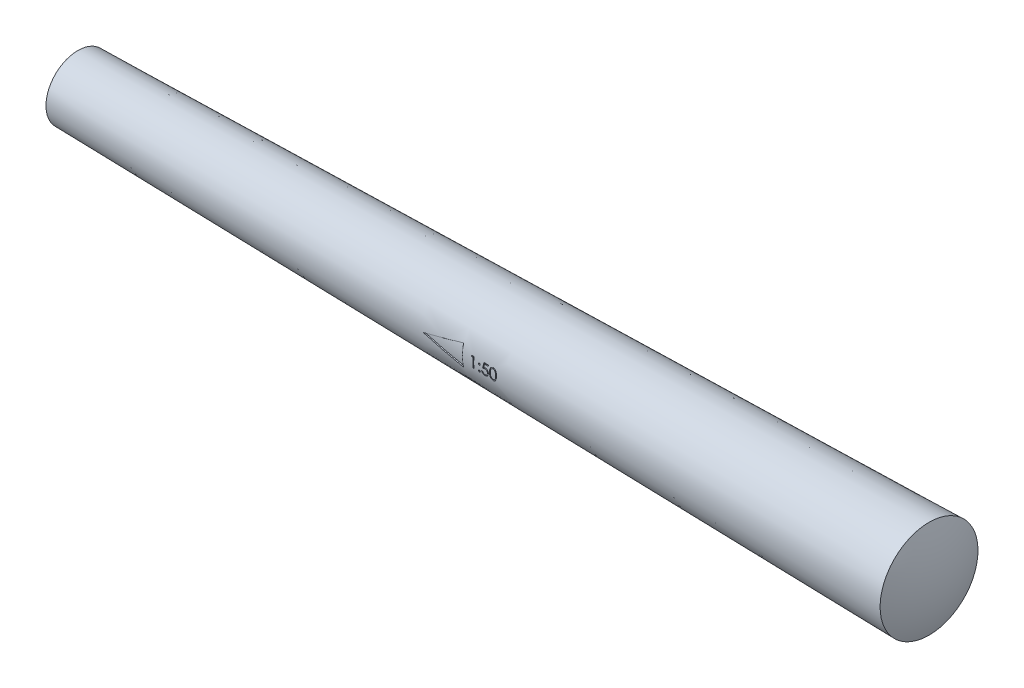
SolidWorks part; units mm, degrees
ref_plane "Front Plane" through (0, 0, 0) normal (0, 0, 1) x (1, 0, 0)
ref_plane "Top Plane" through (0, 0, 0) normal (0, 1, 0) x (1, 0, 0)
ref_plane "Right Plane" through (0, 0, 0) normal (1, 0, 0) x (0, 0, -1)
sketch "Sketch1" plane through (0, 0, 0) normal (1, 0, 0) x (0, 0, -1)
  circle A0 centre (0, 0) radius 3
  dimension "D1" = 6
extrude "Extrude1" add sketch "Sketch1" along normal mid plane 80
draft "Draft1" type of draft neutral plane draft angle 1.146 faces to draft 1 parameters "D1"=1.146
sketch "Sketch2" plane through (0, 0, 0) normal (0, 0, 1) x (1, 0, 0)
  line L0 (-40, 0) -> (-40, 3)
  line L1 (-40, 3) -> (-40, -3) construction
  line L2 (-40, 0) -> (-40.9, 0)
  line L3 (-40.9, 0) -> (-40.9, -3.8) construction
  line L4 (40, 0) -> (40, 4.6001)
  line L5 (40, -4.6001) -> (40, 4.6001) construction
  line L6 (40, 0) -> (40.9, 0)
  line L7 (40.9, 0) -> (40.9, -3.8) construction
  line L8 (-40, -3) -> (40, -4.6001) construction
  arc A0 (-40.9, 0) -> (-40, 3) centre (-35.45, 0) cw
  arc A1 (40.9, 0) -> (40, 4.6001) centre (28.6942, 0) ccw
  point P14 (0, -3.8)
revolve "Revolve1" add sketch "Sketch2" angle 360 about L2
sketch "Sketch5" plane through (0, 0, 0) normal (0, 0, 1) x (1, 0, 0)
  line L0 (0, 3.8) -> (0, -3.8) construction
  line L1 (40, 4.6001) -> (-40, 3) construction
  line L2 (-40, -3) -> (40, -4.6001) construction
ref_plane "Plane2" through (0, 0, 0) normal (-0.02, 0, 0.9998) x (0.9998, 0, 0.02)
sketch "Sketch6" plane through (0, 0, 0) normal (-0.02, 0, 0.9998) x (0.9998, 0, 0.02)
  line L0 (0, 0) -> (0, 1)
  line L1 (0, 3.8) -> (0, -3.8) construction
  line L2 (0, 1) -> (-3.7321, 0)
  line L3 (-3.7321, 0) -> (0, -1)
  line L4 (0, -1) -> (0, 0)
  line L5 (0, -0.5) -> (4, -0.5) construction
  text T0 "1:50" font "Century Gothic" height 1
  dimension "D1" = 2
  dimension "D2" = 30
  dimension "D3" = 4
wrap "Wrap2" sketch "Sketch6" wrap type deboss source sketch "Sketch6" thickness 0.1 parameters "D1"=0.1
equation "\"D2@Sketch2\" = \"D1@Sketch2\""
